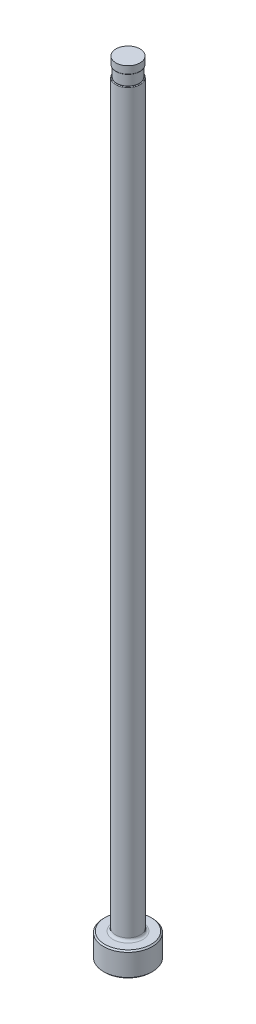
SolidWorks part; units mm, degrees
ref_plane "Front Plane" through (0, 0, 0) normal (0, 0, 1) x (1, 0, 0)
ref_plane "Top Plane" through (0, 0, 0) normal (0, 1, 0) x (1, 0, 0)
ref_plane "Right Plane" through (0, 0, 0) normal (1, 0, 0) x (0, 0, -1)
other "Configuration Table"
sketch "Sketch1" plane through (0, 0, 0) normal (0, 0, 1) x (1, 0, 0)
  line L0 (0, 259.9588) -> (0, -15.1925) construction
  line L1 (0, 0) -> (-4.7625, 0)
  line L2 (-4.7625, 0) -> (-4.7625, 4.7498)
  line L3 (-4.7625, 4.7498) -> (-2.3812, 4.7498)
  line L4 (-2.3812, 4.7498) -> (-2.3812, 152.4)
  line L5 (-2.3812, 152.4) -> (0, 152.4)
  line L6 (0, 152.4) -> (0, 0)
  dimension "L" = 152.4
  dimension "H" = 9.525
  dimension "T" = 4.7498
  dimension "D" = 4.7625
revolve "Revolve1" add sketch "Sketch1" angle 360 about L0
chamfer "Chamfer1" distance 0.254 angle 45 2 edges at (0, 4.7498, 4.7625) (0, 0, 4.7625)
fillet "Fillet1" radius 0.508 1 edges at (0, 4.7498, 2.3812)
sketch "Sketch2" plane through (0, 0, 0) normal (0, 0, 1) x (1, 0, 0)
  line L0 (-2.3812, 152.4) -> (-2.3812, 5.2578) construction
  line L1 (-2.3812, 150.876) -> (-2.178, 150.876)
  line L2 (-2.3812, 150.876) -> (-2.3812, 148.844)
  line L3 (-2.3812, 148.844) -> (-2.178, 148.844)
  line L4 (-2.178, 150.876) -> (-2.178, 148.844)
  line L5 (2.3812, 152.4) -> (-2.3812, 152.4) construction
  line L6 (0, 153.4483) -> (0, 147.3282) construction
  dimension "D1" = 2.032
  dimension "N" = 1.524
  dimension "FD" = 0.2032
  dimension "D3" = 4.3561
revolve "Vent Relief" cut sketch "Sketch2" angle 360 about L6
sketch "Sketch3" plane through (0, 0, 0) normal (0, 0, 1) x (1, 0, 0)
  line L0 (-2.178, 149.86) -> (-2.178, 86.36)
  line L1 (-2.178, 150.876) -> (-2.178, 148.844) construction
  line L2 (-2.3812, 148.844) -> (-2.3812, 5.2578) construction
  line L3 (-2.3812, 85.2424) -> (-2.3812, 149.86)
  line L4 (-2.3812, 149.86) -> (-2.178, 149.86)
  arc A0 (-2.178, 86.36) -> (-2.3812, 85.2424) centre (-5.353, 86.36) cw
  dimension "D1" = 3.175
  dimension "D2" = 63.5
extrude "D-Slot" cut sketch "Sketch3" against normal through all both and the other way through all
sketch "Sketch5" plane through (0, 0, 0) normal (0, 0, 1) x (1, 0, 0)
  line L0 (-2.3812, 150.876) -> (2.3812, 150.876) construction
  line L1 (-2.3812, 152.4) -> (-2.3558, 152.4)
  line L2 (-2.3812, 152.4) -> (-2.3812, 150.876)
  line L3 (-2.3812, 150.876) -> (-2.3558, 150.876)
  line L4 (-2.3558, 152.4) -> (-2.3558, 150.876)
  line L5 (0, 152.6877) -> (0, 150.5771) construction
  dimension "VP" = 0.0254
revolve "Vent Diameter" cut sketch "Sketch5" angle 360 about L5
fillet "Fillet2" radius 0.127 2 edges at (2.3812, 148.844, 0) (0, 150.876, 2.3558)
sketch "Pocket Sketch" plane through (0, 0, 0) normal (0, 0, 1) x (1, 0, 0)
  line L0 (-5.1594, 0) -> (-5.1594, 4.7752)
  line L1 (-5.1594, 4.7752) -> (-3.3417, 4.7752)
  line L2 (-2.5797, 5.5372) -> (-2.5797, 22.225)
  line L3 (-2.5797, 22.225) -> (0, 22.225)
  line L4 (0, 22.225) -> (0, 0)
  line L5 (0, 0) -> (-5.1594, 0)
  line L6 (0, 12.6104) -> (0, -2.4989) construction
  line L7 (-4.7625, 4.4958) -> (-4.7625, 0.254) construction
  line L8 (4.5085, 4.7498) -> (-4.5085, 4.7498) construction
  line L9 (-2.3812, 85.2424) -> (-2.3812, 5.2578) construction
  line L10 (-3.3417, 4.7752) -> (-2.5797, 5.5372)
  point P3 (-2.5797, 4.7752)
  dimension "D1" = 10.3187
  dimension "D2" = 0.3969
  dimension "D3" = 0.0254
  dimension "D4" = 0.1984
  dimension "D5" = 5.1594
  dimension "D6" = 22.225
